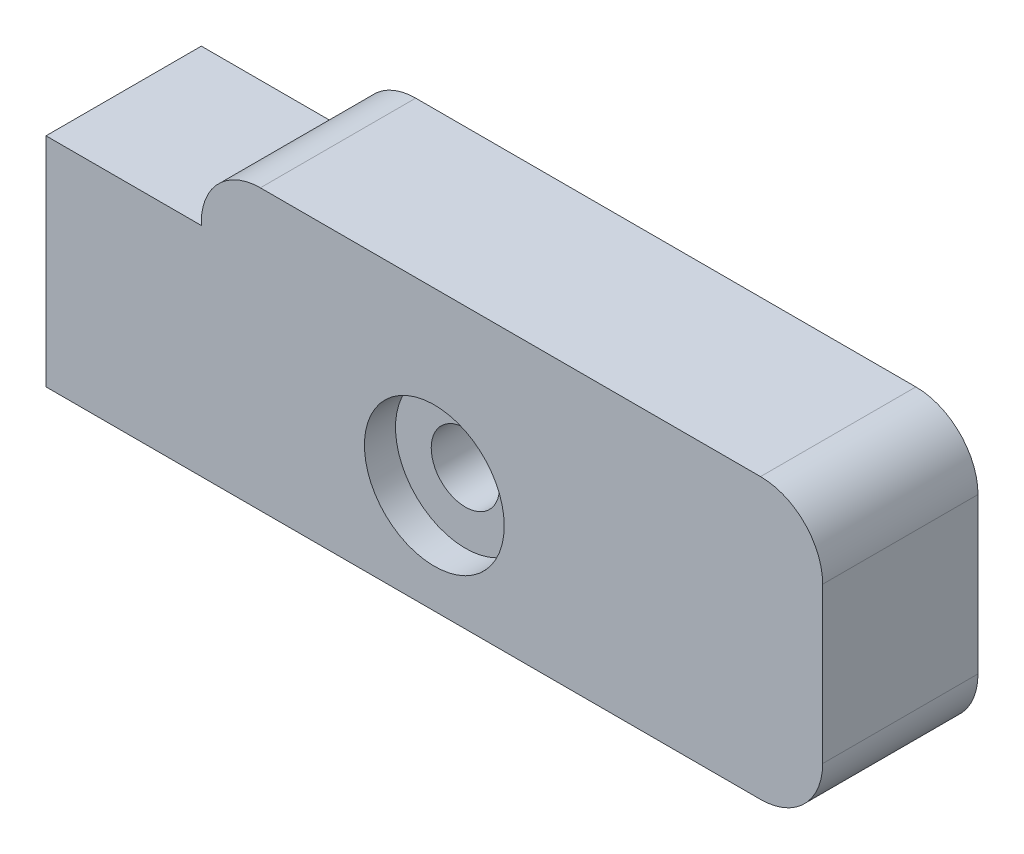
SolidWorks part; units mm, degrees
ref_plane "Plan de face" through (0, 0, 0) normal (0, 0, 1) x (1, 0, 0)
ref_plane "Plan de dessus" through (0, 0, 0) normal (0, 1, 0) x (1, 0, 0)
ref_plane "Plan de droite" through (0, 0, 0) normal (1, 0, 0) x (0, 0, -1)
sketch "Esquisse1" plane through (0, 0, 0) normal (0, 0, 1) x (1, 0, 0)
  line L0 (0, -2.6373) -> (0, 15.3001) construction
  line L1 (-2.485, 0) -> (21.9878, 0) construction
  line L2 (5, -2.6373) -> (5, 15.3001) construction
  line L3 (-2.485, 9) -> (21.9878, 9) construction
  line L4 (25, -2.6373) -> (25, 15.3001) construction
  line L5 (-2.485, 7) -> (21.9878, 7) construction
  line L6 (0, 0) -> (0, 7)
  line L7 (0, 7) -> (5, 7)
  line L8 (5, 7) -> (5, 7.1)
  line L9 (6.9, 9) -> (23, 9)
  line L10 (25, 7) -> (25, 2)
  line L11 (23, 0) -> (0, 0)
  arc A0 (25, 2) -> (23, 0) centre (23, 2) cw
  arc A1 (23, 9) -> (25, 7) centre (23, 7) cw
  arc A2 (5, 7.1) -> (6.9, 9) centre (6.9, 7.1) cw
  point P21 (25, 0)
  point P24 (25, 9)
  point P27 (5, 9)
  dimension "D5" = 2
  dimension "D6" = 1.9
  dimension "D1" = 7
  dimension "D2" = 2
  dimension "D3" = 5
  dimension "D4" = 20
extrude "Boss.-Extru.1" add sketch "Esquisse1" along normal blind 5
sketch "Esquisse2" plane through (0, 0, 0) normal (0, 0, -1) x (-1, 0, 0)
  line L0 (0, 0) -> (-23, 0) construction
  line L2 (-12.4996, 3.5) -> (-12.4996, 7.2951) construction
  circle A0 centre (-12.4996, 3.5) radius 2.1
  circle A1 centre (-12.4996, 3.5) radius 3
  circle A2 centre (-12.4996, 3.5) radius 2.0084 construction
  dimension "D1" = 3.5
extrude "Boss.-Extru.2" add sketch "Esquisse2" along normal blind 2.5
sketch "Esquisse3" plane through (0, 0, 0) normal (-1, 0, 0) x (0, 0, 1)
  line L0 (5, 7) -> (5, 0) construction
  line L1 (1, 6) -> (4, 6)
  line L2 (1, 6) -> (1, 1)
  line L3 (1, 1) -> (4, 1)
  line L4 (4, 6) -> (4, 1)
  line L5 (5, 7) -> (0, 7) construction
  line L6 (5, 0) -> (0, 0) construction
  line L7 (0, 6.5) -> (0, 0.5) construction
  dimension "D1" = 1
  dimension "D2" = 1
  dimension "D3" = 1
  dimension "D4" = 1
extrude "Enlèv. mat.-Extru.1" cut sketch "Esquisse3" against normal blind 9
sketch "Esquisse4" plane through (0, 0, 0) normal (0, 0, -1) x (-1, 0, 0)
  circle A0 centre (-12.4996, 3.5) radius 1.1
extrude "Enlèv. mat.-Extru.2" cut sketch "Esquisse4" against normal blind 10
sketch "Esquisse5" plane through (0, 0, 5) normal (0, 0, 1) x (1, 0, 0)
  circle A0 centre (12.4996, 3.5) radius 2.25
extrude "Enlèv. mat.-Extru.3" cut sketch "Esquisse5" against normal blind 1
